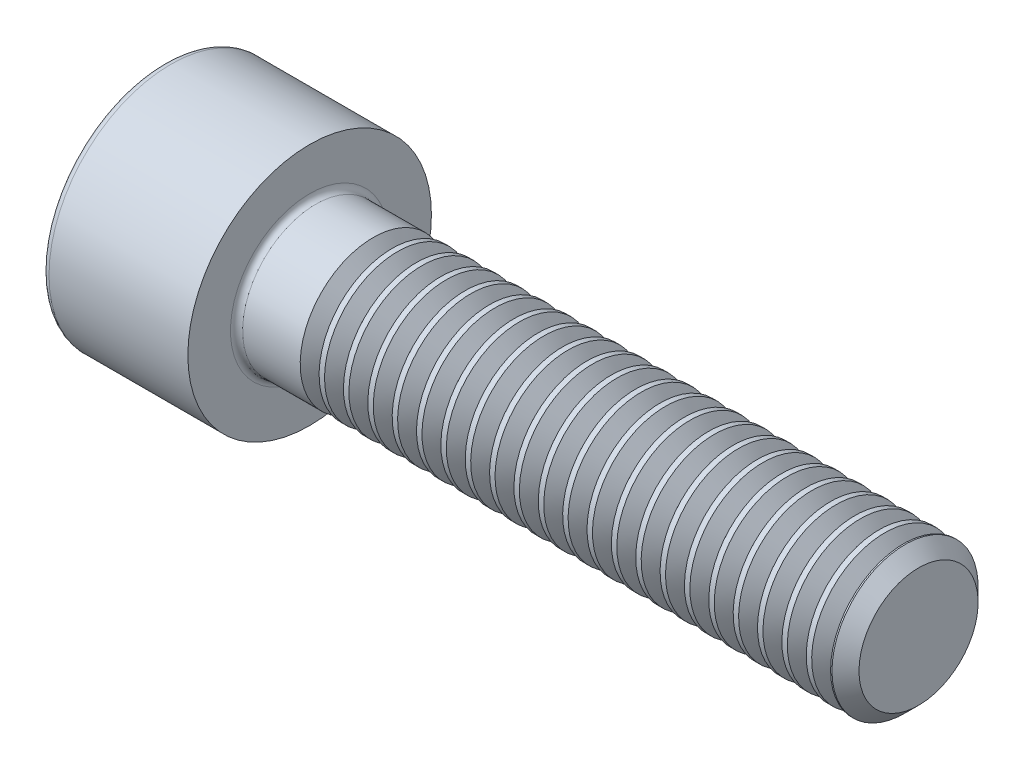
SolidWorks part; units mm, degrees
ref_plane "Plane1" through (0, 0, 0) normal (0, 0, 1) x (1, 0, 0)
ref_plane "Plane2" through (0, 0, 0) normal (0, 1, 0) x (1, 0, 0)
ref_plane "Plane3" through (0, 0, 0) normal (1, 0, 0) x (0, 0, -1)
sketch "BodySke" plane through (0, 0, 0) normal (0, 0, 1) x (1, 0, 0)
  line L0 (0, 0) -> (0, 5)
  line L1 (0, 5) -> (6, 5)
  line L2 (6, 5) -> (6, 3)
  line L3 (6, 3) -> (30.4455, 3)
  line L4 (31, 2.4455) -> (31, 0)
  line L5 (31, 0) -> (0, 0)
  line L6 (-31.75, 0) -> (127, 0) construction
  line L8 (31, 2.4455) -> (30.4455, 3)
  line L10 (31, -2.4455) -> (30.4455, -3) construction
  line L11 (7, 9.525) -> (7, 3.175) construction
  line L12 (6, 9.525) -> (6, 3.175) construction
  line L13 (-29, 9.525) -> (-29, 3.175) construction
  dimension "Diameter" = 6
  dimension "Head_ht" = 6
  dimension "Length" = 25
  dimension "Body_ch_ang" = 45
  dimension "Head_dia" = 10
  dimension "Minor_dia" = 4.891
  dimension "Advance" = 1
  dimension "Thread_nom" = 25
  dimension "Thread_length" = 60
revolve "Base-Revolve" add sketch "BodySke"
fillet "Fillet1" radius 0.25 1 edges at (6, 0, 3)
fillet "Fillet2" radius 0.3 1 edges at (0, 0, 5)
sketch "Sketch2" plane through (0, 0, 0) normal (0, 0, 1) x (1, 0, 0)
  line L0 (0, 2.542) -> (3, 2.542)
  line L1 (3, 2.542) -> (4.4676, 0)
  line L2 (-31.75, 0) -> (127, 0) construction
  line L3 (4.4676, 0) -> (0, 0)
  line L4 (0, 0) -> (0, 2.542)
  line L6 (0, 0) -> (47.625, 0) construction
  dimension "D1" = 2.542
  dimension "D2" = 60
  dimension "Depth" = 3
revolve "Hex-PreBroach" cut sketch "Sketch2" angle 360 about L6
sketch "Sketch3" plane through (0, 0, 0) normal (-1, 0, 0) x (0, 0.5, 0.866)
  line L0 (1.4676, 2.542) -> (-1.4676, 2.542)
  line L1 (-1.4676, 2.542) -> (-2.9352, 0)
  line L2 (1.4676, 2.542) -> (2.9352, 0)
  line L3 (1.4676, -2.542) -> (2.9352, 0)
  line L4 (1.4676, -2.542) -> (-1.4676, -2.542)
  line L5 (-1.4676, -2.542) -> (-2.9352, 0)
  dimension "D1" = 2.542
  dimension "D2" = 2.542
  dimension "Hex_size" = 5.084
extrude "Hex" cut sketch "Sketch3" against normal blind 3
sketch "ThdSchSke" plane through (0, 0, 0) normal (0, 0, 1) x (1, 0, 0)
  line L0 (9, -2.4455) -> (8.6117, -3)
  line L1 (9, -2.4455) -> (9.3883, -3)
  line L2 (9.3883, -3) -> (9.3883, -3.75)
  line L3 (-3.175, 0) -> (5.1513, 0) construction
  line L4 (0, 4.7) -> (0, -4.7) construction
  line L5 (9.3883, -3.75) -> (8.6117, -3.75)
  line L6 (8.6117, -3.75) -> (8.6117, -3)
  dimension "Thread_minor" = 4.891
  dimension "Diameter" = 6
  dimension "Start" = 9
  dimension "SideAngle" = 55
  dimension "VeeAngle" = 70
  dimension "Overcut" = 7.5
revolve "ThreadSchematic" cut sketch "ThdSchSke" angle 360 about L3
pattern_linear "ThdSchPat" count 22 spacing 1 along (1, 0, 0) of "ThreadSchematic"
equation "\"D2@Sketch3\" = \"Hex_size@Sketch3\" / 2"
equation "\"D1@Sketch3\" = \"Hex_size@Sketch3\" / 2"
equation "\"D1@Sketch2\" = \"Hex_size@Sketch3\" / 2"
equation "\"Thread_minor@ThreadCosmetic\"  =  \"Minor_dia@BodySke\""
equation "\"Depth@Sketch2\" =  \"Key_eng@Hex\""
equation "\"Thread_length@ThreadCosmetic\" = ((sgn( (\"Length@BodySke\" - \"Advance@BodySke\" * 3.0) - \"Thread_nom@BodySke\" )-1)*( (\"Length@BodySke\" - \"Advance@BodySke\" * 3.0) - \"Thread_nom@BodySke\" ))/-2+ \"Thread_no"
equation "\"Thread_minor@ThdSchSke\" = \"Minor_dia@BodySke\""
equation "\"Diameter@ThdSchSke\" = \"Diameter@BodySke\""
equation "\"Overcut@ThdSchSke\" = \"Diameter@BodySke\" * 1.25"
equation "\"Start@ThdSchSke\" = \"Head_ht@BodySke\" + \"Length@BodySke\" - \"Thread_length@ThreadCosmetic\"  '---Non-countersunk---"
equation "\"Num_threads@ThdSchPat\" = int( \"Thread_length@ThreadCosmetic\" / \"Advance@BodySke\" + 0.999 )  + 1"
equation "\"Advance@ThdSchPat\" = \"Thread_length@ThreadCosmetic\" /  (\"Num_threads@ThdSchPat\" - 1) 'relax it"
equation "\"Num_threads@ThdSchPat\" = \"Num_threads@ThdSchPat\" - sgn( \"Num_threads@ThdSchPat\" - 1) '---chamfered tips only---"
